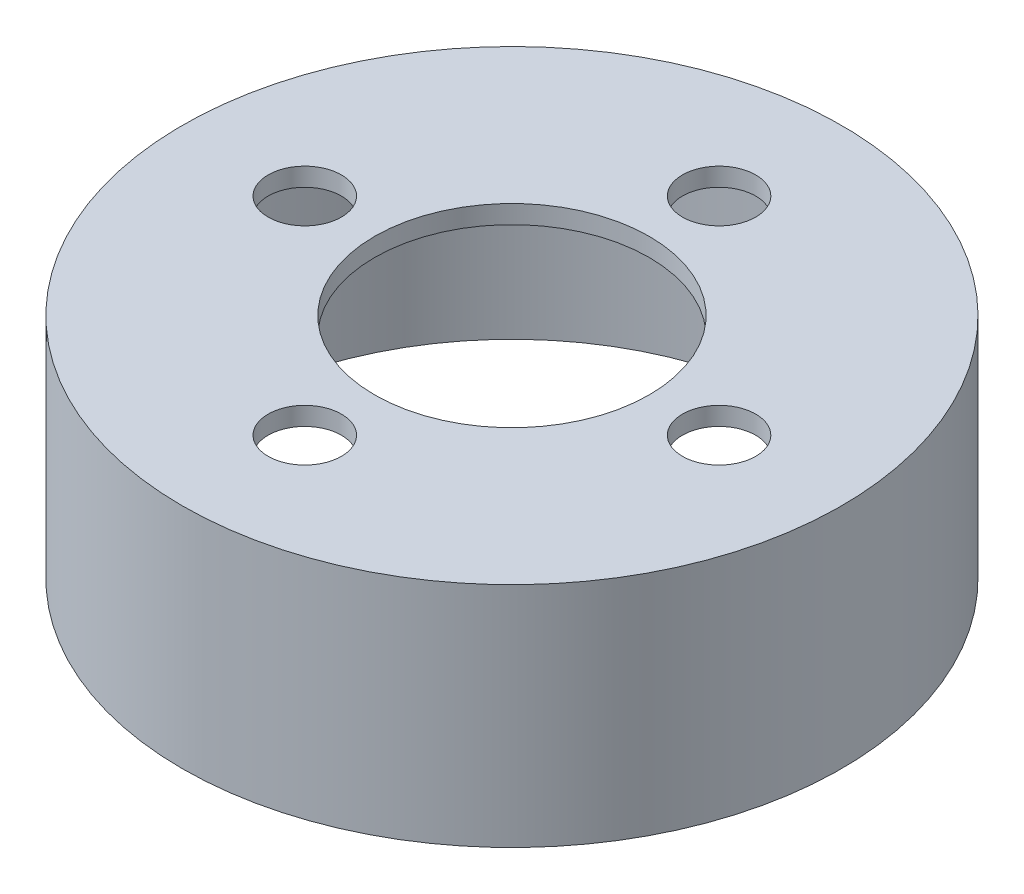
SolidWorks part; units mm, degrees
ref_plane "Front Plane" through (0, 0, 0) normal (0, 0, 1) x (1, 0, 0)
ref_plane "Top Plane" through (0, 0, 0) normal (0, 1, 0) x (1, 0, 0)
ref_plane "Right Plane" through (0, 0, 0) normal (1, 0, 0) x (0, 0, -1)
sketch "Sketch2" plane through (0, 0, 0) normal (0, 1, 0) x (1, 0, 0)
  circle A0 centre (0, 0) radius 16
  circle A1 centre (0, 0) radius 18
  dimension "D1" = 32
  dimension "D2" = 2
extrude "Boss-Extrude2" add sketch "Sketch2" against normal blind 12.4337
sketch "Sketch3" plane through (0, 0, 0) normal (0, 1, 0) x (1, 0, 0)
  circle A0 centre (0, 0) radius 16
  circle A1 centre (0, 0) radius 7.5
  dimension "D1" = 15
extrude "Boss-Extrude3" add sketch "Sketch3" against normal blind 1
sketch "Sketch4" plane through (0, 0, 0) normal (0, 1, 0) x (1, 0, 0)
  circle A0 centre (0, -11.3137) radius 2
  dimension "D1" = 4
  dimension "D2" = 11.3137
extrude "Cut-Extrude1" cut sketch "Sketch4" along direction (0, 1, 0) on the side against the normal up to next (1 mm away)
pattern_circular "CirPattern1" count 4 over 360 about axis through (0, 0, 0) along (0, 1, 0) of "Cut-Extrude1"
